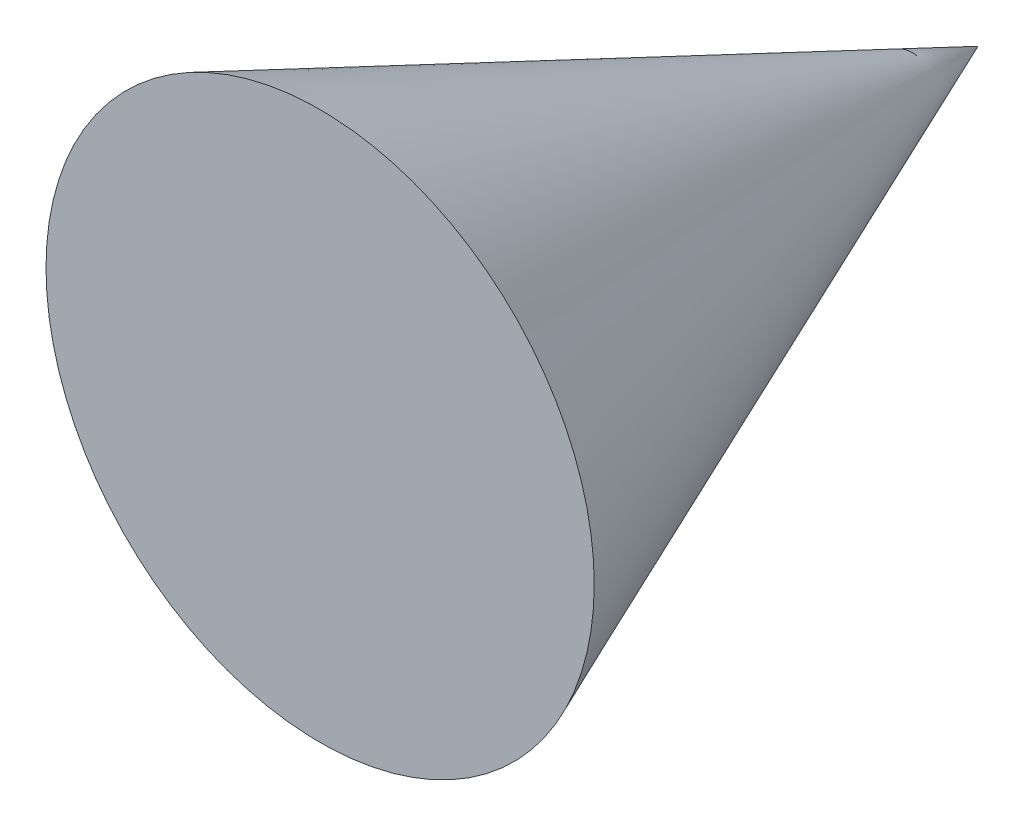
SolidWorks part; units mm, degrees
ref_plane "前视基准面" through (0, 0, 0) normal (0, 0, 1) x (1, 0, 0)
ref_plane "上视基准面" through (0, 0, 0) normal (0, 1, 0) x (1, 0, 0)
ref_plane "右视基准面" through (0, 0, 0) normal (1, 0, 0) x (0, 0, -1)
sketch "草图1" plane through (0, 0, 0) normal (0, 1, 0) x (1, 0, 0)
  line L0 (0, 88.9) -> (0, -85.1647) construction
  line L1 (0, 25.6353) -> (-25, -34.3647)
  line L2 (-25, -34.3647) -> (0, -34.3647)
  line L3 (0, 25.6353) -> (0, -34.3647)
  dimension "D1" = 25
  dimension "D2" = 60
revolve "旋转1" add sketch "草图1" angle 360 about L0
